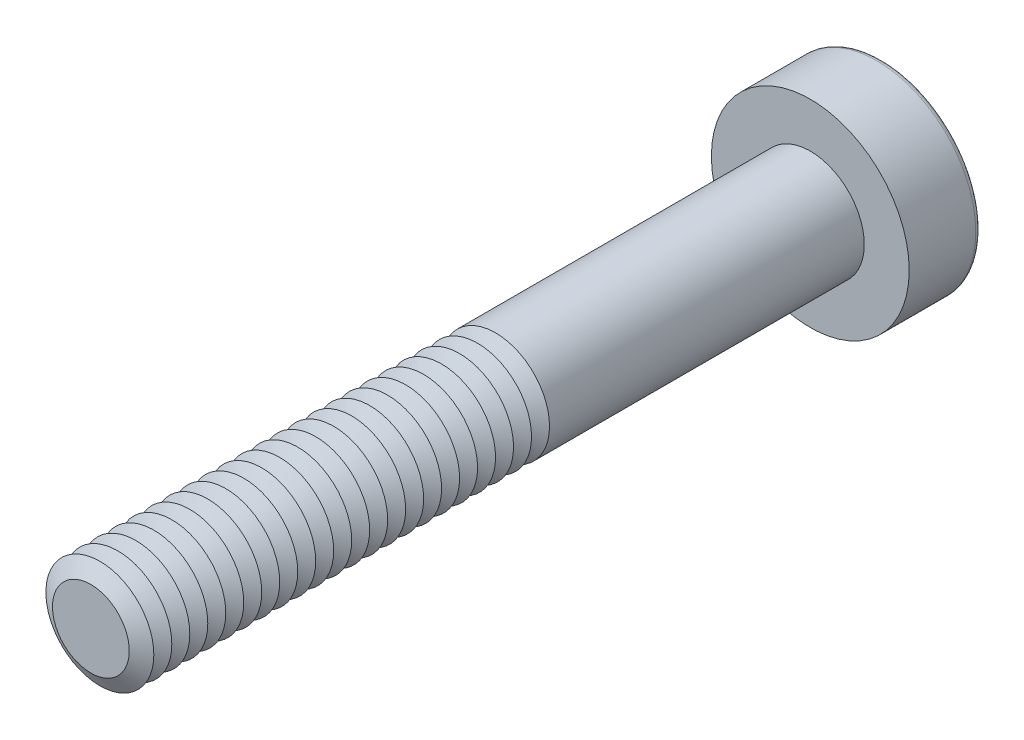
SolidWorks part; units mm, degrees
ref_plane "Front Plane" through (0, 0, 0) normal (0, 0, 1) x (1, 0, 0)
ref_plane "Top Plane" through (0, 0, 0) normal (0, 1, 0) x (1, 0, 0)
ref_plane "Right Plane" through (0, 0, 0) normal (1, 0, 0) x (0, 0, -1)
sketch "Sketch1" plane through (0, 0, 0) normal (0, 0, 1) x (1, 0, 0)
  circle A0 centre (0, 0) radius 1.5
  dimension "D1" = 3
extrude "Boss-Extrude1" add sketch "Sketch1" along normal blind 20
sketch "Sketch2" plane through (0, 0, 0) normal (0, 0, -1) x (-1, 0, 0)
  circle A0 centre (0, 0) radius 2.75
  dimension "D1" = 5.5
extrude "Boss-Extrude2" add sketch "Sketch2" along normal blind 2
sketch "Sketch3" plane through (0, 0, -2) normal (0, 0, -1) x (-1, 0, 0)
  line L1 (-0.5774, 1) -> (-1.1547, 0)
  line L2 (-1.1547, 0) -> (-0.5774, -1)
  line L3 (-0.5774, -1) -> (0.5774, -1)
  line L4 (0.5774, -1) -> (1.1547, 0)
  line L5 (1.1547, 0) -> (0.5774, 1)
  line L6 (0.5774, 1) -> (-0.5774, 1)
  circle A0 centre (0, 0) radius 1 construction
  dimension "D1" = 2
extrude "Cut-Extrude1" cut sketch "Sketch3" against normal blind 1.5
fillet "Fillet1" radius 0.15 1 edges at (-2.75, 0, -2)
sketch "Sketch4" plane through (0, 0, -0.5) normal (0, 0, -1) x (-1, 0, 0)
  line L0 (0.5774, -1) -> (1.1547, 0) construction
  circle A0 centre (0, 0) radius 1
extrude "Cut-Extrude2" cut sketch "Sketch4" against normal through all draft 60
sketch "Sketch5" plane through (0, 0, -2) normal (0, 0, -1) x (-1, 0, 0)
  circle A0 centre (0, 0) radius 1.1547
extrude "Cut-Extrude3" cut sketch "Sketch5" against normal through all draft 75
sketch "Sketch7" plane through (0, 0, 0) normal (1, 0, 0) x (0, 0, -1)
  line L25 (-20, 1.067) -> (-19.75, 1.5)
  line L26 (-20, 1.5) -> (-20, -1.5) construction
  line L27 (-19.75, 1.5) -> (-20.25, 1.5)
  line L28 (-20.25, 1.5) -> (-20, 1.067)
  line L29 (0, 1.5) -> (-20, 1.5) construction
  dimension "D1" = 0.5
revolve "Cut-Revolve1" cut sketch "Sketch7" angle 360 about axis through (0, 0, 20) along (0, 0, -1)
pattern_linear "LPattern1" count 23 spacing 0.5 along (0, 0, -1) of "Cut-Revolve1"
